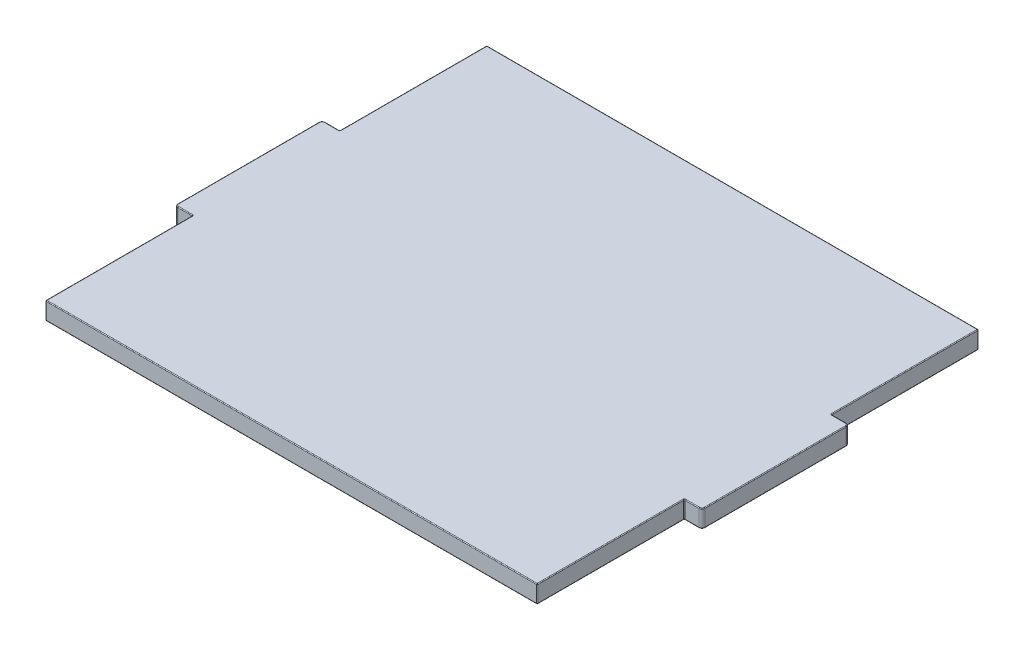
SolidWorks part; units mm, degrees
ref_plane "Front Plane" through (0, 0, 0) normal (0, 0, 1) x (1, 0, 0)
ref_plane "Top Plane" through (0, 0, 0) normal (0, 1, 0) x (1, 0, 0)
ref_plane "Right Plane" through (0, 0, 0) normal (1, 0, 0) x (0, 0, -1)
sketch "Sketch1" plane through (0, 0, 0) normal (0, 1, 0) x (1, 0, 0)
  line L0 (-179.125, 0) -> (-167.125, 0) construction
  line L1 (-167.125, 150) -> (167.125, 150)
  line L2 (-167.125, 150) -> (-167.125, 50)
  line L3 (-167.125, -150) -> (167.125, -150)
  line L4 (167.125, 150) -> (167.125, 50)
  line L5 (-167.125, 150) -> (167.125, -150) construction
  line L6 (-167.125, -150) -> (167.125, 150) construction
  line L7 (-179.125, 124.9776) -> (-179.125, -133.8718) construction
  line L8 (-179.125, 50) -> (-167.125, 50)
  line L9 (-179.125, -50) -> (-167.125, -50)
  line L10 (-179.125, 50) -> (-179.125, -50)
  line L11 (-167.125, -50) -> (-167.125, -150)
  line L12 (0, 0) -> (167.125, 0) construction
  line L13 (0, 176.5031) -> (0, -206.9166) construction
  line L14 (179.125, -50) -> (167.125, -50)
  line L15 (179.125, 50) -> (167.125, 50)
  line L16 (179.125, 50) -> (179.125, -50)
  line L17 (167.125, -50) -> (167.125, -150)
  line L18 (179.125, 0) -> (301.9776, 0) construction
  point P0 (0, 0)
  dimension "D1" = 334.25
  dimension "D2" = 300
  dimension "D3" = 12
  dimension "D4" = 50
extrude "Boss-Extrude1" add sketch "Sketch1" along normal blind 12
fillet "Fillet1" radius 0.5 32 edges at (-167.125, 6, 50) (-167.125, 6, -150) (-167.125, 6, -50) (167.125, 6, -50) (167.125, 6, -150) (167.125, 6, 50) (-167.125, 6, 150) (167.125, 6, 150) (173.125, 0, 50) (179.125, 0, 0) (173.125, 0, -50) (167.125, 0, -100) (0, 0, -150) (-167.125, 0, -100) (-173.125, 0, -50) (-179.125, 0, 0) (-173.125, 0, 50) (-167.125, 0, 100) (0, 0, 150) (167.125, 0, 100) (0, 12, 150) (-167.125, 12, 100) (-173.125, 12, 50) (-179.125, 12, 0) (-173.125, 12, -50) (-167.125, 12, -100) (0, 12, -150) (167.125, 12, -100) (173.125, 12, -50) (179.125, 12, 0) (173.125, 12, 50) (167.125, 12, 100)
fillet "Fillet2" radius 2 12 edges at (-178.9786, 0.1464, -49.8536) (-178.9786, 11.8536, -49.8536) (-178.9786, 0.1464, 49.8536) (-178.9786, 11.8536, 49.8536) (178.9786, 0.1464, 49.8536) (178.9786, 11.8536, 49.8536) (178.9786, 0.1464, -49.8536) (178.9786, 11.8536, -49.8536) (179.125, 6, -50) (179.125, 6, 50) (-179.125, 6, 50) (-179.125, 6, -50)
